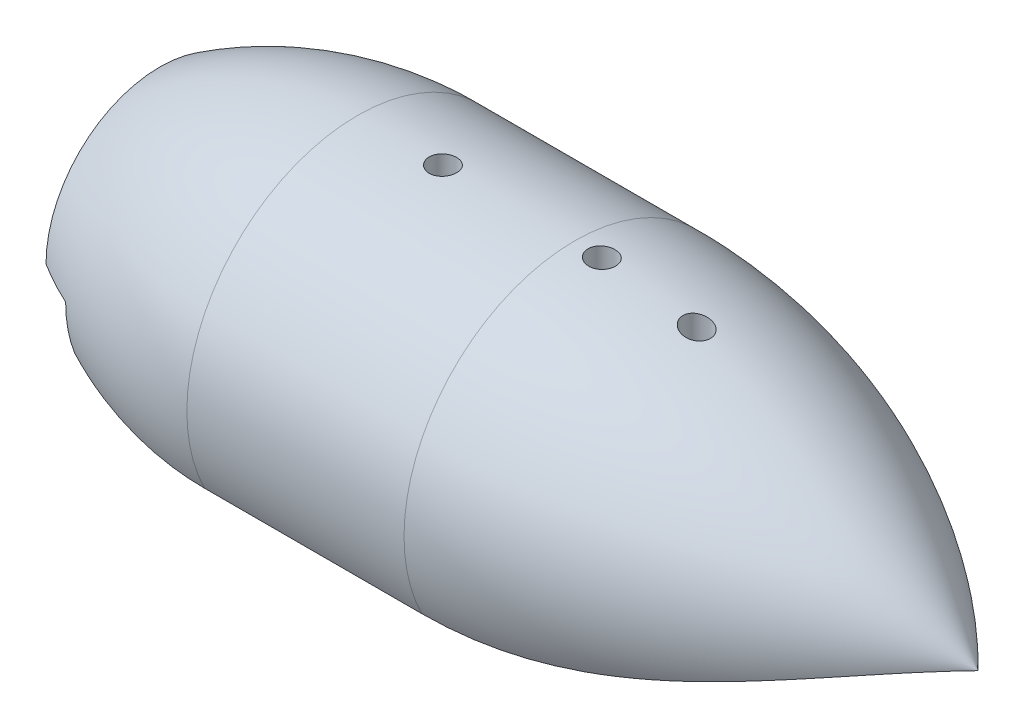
SolidWorks part; units mm, degrees
ref_plane "Front Plane" through (0, 0, 0) normal (0, 0, 1) x (1, 0, 0)
ref_plane "Top Plane" through (0, 0, 0) normal (0, 1, 0) x (1, 0, 0)
ref_plane "Right Plane" through (0, 0, 0) normal (1, 0, 0) x (0, 0, -1)
sketch "Sketch2" plane through (0, 0, 0) normal (1, 0, 0) x (0, 0, -1)
  circle A0 centre (0, 0) radius 18.288
  dimension "D1" = 36.576
extrude "Extrude1" add sketch "Sketch2" along normal blind 87.63
sketch "Sketch3" plane through (0, 0, 0) normal (0, 0, 1) x (1, 0, 0)
  line L0 (87.63, -18.288) -> (87.63, 18.288) construction
  line L2 (44.45, 0) -> (44.45, 18.288) construction
  line L3 (87.63, 18.288) -> (0, 18.288) construction
  line L4 (87.63, 0.0088) -> (87.63, 18.288)
  line L5 (87.63, 18.288) -> (44.45, 18.288)
  line L6 (0, 0) -> (21.1849, 0) construction
  line L7 (21.1849, 0) -> (21.1849, 18.288) construction
  line L8 (0, 0) -> (0, 12.192) construction
  line L9 (0, 18.288) -> (0, -18.288) construction
  line L10 (21.1849, 18.288) -> (0, 18.288)
  line L11 (0, 18.288) -> (0, 12.192)
  arc A0 (44.45, 18.288) -> (87.63, 0.0088) centre (44.45, -41.8525) cw
  arc A1 (21.1849, 18.288) -> (0, 12.192) centre (21.1849, -21.5709) ccw
  dimension "D1" = 12.192
revolve "shape" cut sketch "Sketch3" angle 360 about L6
sketch "Sketch5" plane through (0, 0, 0) normal (-1, 0, 0) x (0, 0, 1)
  circle A0 centre (0, 0) radius 7.9375
  dimension "D1" = 15.875
extrude "Cut-Extrude2" cut sketch "Sketch5" against normal blind 24.13
sketch "Sketch4" plane through (0, 0, 0) normal (-1, 0, 0) x (0, 0, 1)
  line L0 (0, -20.6375) -> (0, 0) construction
  line L1 (16.3949, -8.103) -> (-16.3949, -8.103)
  line L2 (0, -20.6375) -> (16.3949, -8.103) construction
  line L3 (16.3949, -8.103) -> (16.3949, -20.6375)
  line L4 (16.3949, -20.6375) -> (-16.3949, -20.6375)
  line L5 (-16.3949, -20.6375) -> (-16.3949, -8.103)
  circle A1 centre (0, 0) radius 18.288 construction
  dimension "D1" = 20.6375
  dimension "D2" = 20.6375
extrude "Cut-Extrude1" cut sketch "Sketch4" against normal through all
sketch "Sketch8" plane through (0, 0, 0) normal (0, 1, 0) x (1, 0, 0)
  line L0 (26.2128, 3.2946) -> (26.2128, 11.8036)
  line L1 (26.2128, 3.2946) -> (34.4678, 3.2946)
  line L2 (18.923, 11.8036) -> (26.2128, 11.8036)
  line L3 (26.2128, -3.3094) -> (34.4678, -3.3094)
  line L4 (18.923, 11.8036) -> (18.923, -11.8184)
  line L5 (18.923, -11.8184) -> (26.2128, -11.8184)
  line L6 (26.2128, -11.8184) -> (26.2128, -3.3094)
  line L7 (34.4678, 11.8036) -> (42.3418, 11.8036)
  line L8 (34.4678, -11.8184) -> (34.4678, -3.3094)
  line L9 (34.4678, -11.8184) -> (42.3418, -11.8184)
  line L10 (42.3418, 11.8036) -> (42.3418, -11.8184)
  line L11 (34.4678, 3.2946) -> (34.4678, 11.8036)
  line L12 (42.3418, -0.0074) -> (18.923, -0.0074) construction
  line L13 (0, 0) -> (92.1788, -0.0362) construction
  line L14 (0, 12.192) -> (0, -12.192) construction
  line L15 (26.2128, 3.2946) -> (26.2128, -3.3094) construction
  point P20 (26.2128, -0.0074)
  dimension "D1" = 7.2898
  dimension "D2" = 7.874
  dimension "D3" = 8.255
  dimension "D4" = 18.923
  dimension "D5" = 23.622
  dimension "D6" = 6.604
extrude "camera base and transmitter" cut sketch "Sketch8" along normal blind 12.954 and the other way through all
fillet "Fillet1" radius 1.5875 8 edges at (42.3418, 2.4255, -11.8036) (34.4678, 2.4255, -11.8036) (26.2128, 2.4255, -11.8036) (18.923, 2.4255, -11.8036) (42.3418, 2.4255, 11.8184) (34.4678, 2.4255, 11.8184) (26.2128, 2.4255, 11.8184) (18.923, 2.4255, 11.8184)
sketch "r" plane through (0, 0, 0) normal (0, 1, 0) x (1, 0, 0)
  line L1 (65.7098, -0.0074) -> (42.3418, -0.0074) construction
  line L2 (42.3418, 3.1676) -> (42.3418, -3.1824)
  line L3 (42.3418, -3.1824) -> (65.7098, -3.1824)
  line L4 (65.7098, 3.1676) -> (65.7098, -3.1824)
  line L5 (42.3418, 3.1676) -> (65.7098, 3.1676)
  line L6 (42.3418, -10.2309) -> (42.3418, 10.2161) construction
  line L7 (42.3418, -10.2309) -> (42.3418, 10.2161) construction
  dimension "D1" = 6.35
  dimension "D2" = 23.368
extrude "tab slot" cut sketch "r" along normal blind 10.16 and the other way through all
sketch "Sketch9" plane through (18.923, 0, 0) normal (1, 0, 0) x (0, 0, -1)
  line L1 (-7.874, 7.9375) -> (7.874, 7.9375)
  line L2 (-7.874, 7.9375) -> (-7.874, -2.6127)
  line L3 (-7.874, -2.6127) -> (7.874, -2.6127)
  line L4 (7.874, 7.9375) -> (7.874, -2.6127)
  circle A0 centre (0, 0) radius 7.9375 construction
  dimension "D1" = 10.5502
extrude "Cut-Extrude6" cut sketch "Sketch9" against normal blind 5.588
sketch "Sketch10" plane through (0, 0, 0) normal (0, 1, 0) x (1, 0, 0)
  line L0 (0, 12.192) -> (0, -12.192) construction
  line L1 (0, -12.7042) -> (10.9133, -12.7042)
  line L2 (0, -12.7042) -> (0, 12.8228)
  line L3 (0, 12.8228) -> (10.9133, 12.8228)
  line L4 (10.9133, -12.7042) -> (10.9133, -7.874)
  line L5 (15.1084, 0.0593) -> (0, 0.0593) construction
  line L6 (18.923, 10.2161) -> (18.923, -10.2309) construction
  line L7 (10.9133, -7.874) -> (18.923, -7.874)
  line L8 (18.923, -7.874) -> (18.923, 7.874)
  line L9 (18.923, 7.874) -> (10.9133, 7.874)
  line L11 (10.9133, 7.874) -> (10.9133, 12.8228)
  line L12 (10.9133, -7.874) -> (10.9133, 7.874) construction
  dimension "D1" = 25.527
extrude "holder interface" cut sketch "Sketch10" against normal through all
sketch "Sketch11" plane through (0, 0, 0) normal (0, 0, 1) x (1, 0, 0)
  line L0 (0, 12.192) -> (0, 0) construction
  line L1 (0, -7.3177) -> (4.572, -7.3177)
  line L2 (0, -7.3177) -> (0, 0)
  line L3 (0, 0) -> (4.572, 0)
  line L4 (4.572, -7.3177) -> (4.572, 0)
  line L5 (0.8391, 0) -> (10.9133, 0) construction
  point P6 (0.8391, 0)
  point P7 (5.491, -8.103)
  dimension "D1" = 4.572
extrude "Cut-Extrude8" cut sketch "Sketch11" against normal through all and the other way through all
fillet "Fillet2" radius 3.175 2 edges at (13.335, 4.4698, 7.874) (13.335, 4.4698, -7.874)
fillet "Fillet3" radius 3.175 2 edges at (65.7098, 1.0285, 3.1824) (65.7098, 1.0285, -3.1676)
sketch "Sketch13" plane through (0, 12.954, 0) normal (0, -1, 0) x (1, 0, 0)
  line L3 (26.2128, 3.3094) -> (26.2128, -3.2946) construction
  line L4 (34.4678, 3.3094) -> (34.4678, -3.2946) construction
  line L5 (34.4678, 0.0074) -> (26.2128, 0.0074) construction
sketch "Sketch14" plane through (0, 10.16, 0) normal (0, -1, 0) x (1, 0, 0)
  line L0 (65.7098, 0.0074) -> (34.4678, 0.0074) construction
  line L1 (34.4678, -10.2161) -> (34.4678, -3.2946) construction
  line L2 (34.4678, 3.3094) -> (34.4678, -3.2946) construction
hole_wizard "#4 Clearance Hole1" positions "3DSketch1" profile "Sketch12" hole size "#4" standard "Ansi Inch"
sketch3d "3DSketch1"
  line L1 (65.7098, 10.16, 0.0074) -> (34.4678, 10.16, 0.0074) construction
  line L2 (34.4678, 12.954, 0.0074) -> (26.2128, 12.954, 0.0074) construction
  point P0 (30.3403, 12.954, 0.0074)
  point P2 (47.3583, 10.16, 0.0074)
  point P4 (57.5183, 10.16, 0.0074)
  dimension "D1" = 10.16
  dimension "D2" = 12.8905
sketch "Sketch12" plane through (30.3403, 12.954, 0.0074) normal (1, 0, 0) x (0, 0, -1)
  line L0 (0, 0) -> (0, 5.334)
  line L1 (0, 5.334) -> (1.4732, 5.334)
  line L2 (1.4732, 5.334) -> (1.4732, 0)
  line L5 (1.4732, 0) -> (0, 0)
  line L11 (0, -6.35) -> (0, 107.95) construction
  dimension "Thru Hole Dia." = 2.9464
  dimension "Thru Hole Depth" = 5.334
fillet "Fillet4" radius 3.175 2 edges at (10.9133, -4.0515, -12.8228) (10.9133, -4.0515, 12.7042)
sketch "Sketch15" plane through (0, -8.103, 0) normal (0, -1, 0) x (1, 0, 0)
  circle A0 centre (38.792, 0.0074) radius 4.7625
  dimension "D1" = 9.525
extrude "Cut-Extrude9" cut sketch "Sketch15" against normal offset from surface (22.835 mm away) 1.778
sketch "Sketch16" plane through (0, 0, 0) normal (-1, 0, 0) x (0, 0, 1)
  circle A0 centre (0, -20.6375) radius 20.6375
  dimension "D1" = 41.275
extrude "Cut-Extrude10" cut sketch "Sketch16" against normal through all
ref_plane "Plane1" through (1.397, 0, 0) normal (-1, 0, 0) x (0, 0, 1)
sketch "Sketch18" plane through (1.397, 0, 0) normal (-1, 0, 0) x (0, 0, 1)
  line L2 (-12.192, 0) -> (-7.9375, 0)
  line L3 (7.9375, 0) -> (12.192, 0)
  line L4 (-9.3345, 0) -> (-7.9375, 0)
  line L5 (7.9375, 0) -> (9.3345, 0)
  arc A0 (9.3345, 0) -> (-9.3345, 0) centre (0, 0) ccw
  arc A2 (12.192, 0) -> (-12.192, 0) centre (0, 0) ccw
  arc A3 (7.9375, 0) -> (-7.9375, 0) centre (0, 0) ccw
  arc A5 (7.9375, 0) -> (-7.9375, 0) centre (0, 0) ccw
  dimension "D1" = 0
  dimension "D2" = 1.397
extrude "Cut-Extrude12" cut sketch "Sketch18" against normal blind 1.905
sketch "Sketch19" plane through (0, 0, 0) normal (-1, 0, 0) x (0, 0, 1)
  arc A0 (-16.3949, -8.103) -> (16.3949, -8.103) centre (0, -20.6375) cw
extrude "Cut-Extrude13" cut sketch "Sketch19" against normal through all and the other way through all flip side to cut
